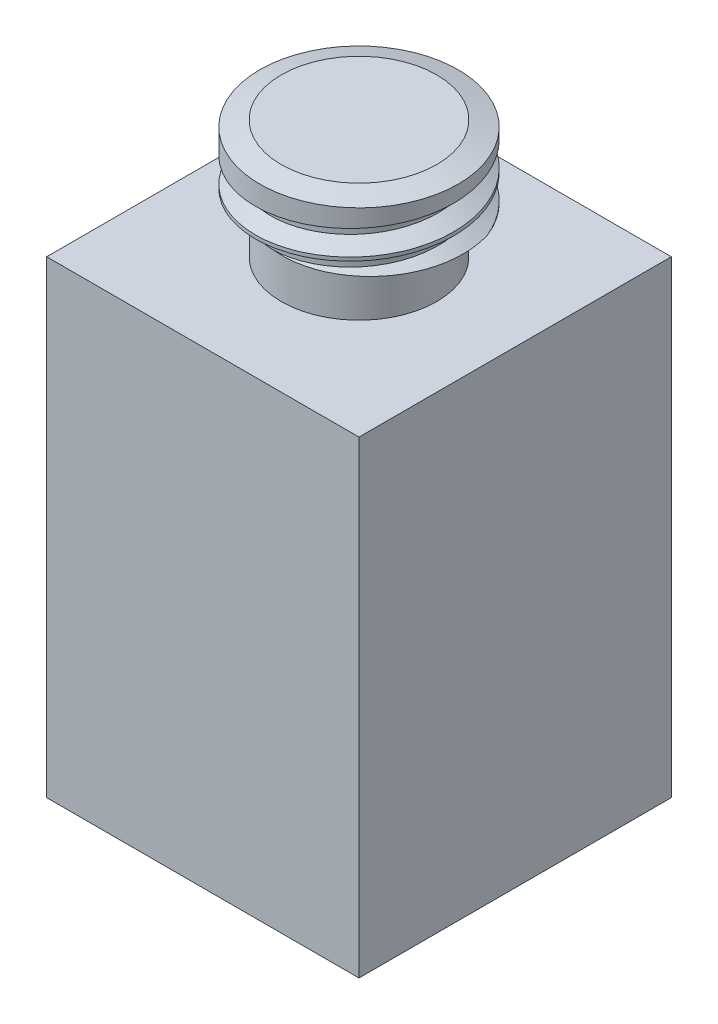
SolidWorks part; units mm, degrees
ref_plane "Front Plane" through (0, 0, 0) normal (0, 0, 1) x (1, 0, 0)
ref_plane "Top Plane" through (0, 0, 0) normal (0, 1, 0) x (1, 0, 0)
ref_plane "Right Plane" through (0, 0, 0) normal (1, 0, 0) x (0, 0, -1)
sketch "Sketch1" plane through (0, 0, 0) normal (0, 1, 0) x (1, 0, 0)
  line L1 (-5, 5) -> (5, 5)
  line L2 (-5, 5) -> (-5, -5)
  line L3 (-5, -5) -> (5, -5)
  line L4 (5, 5) -> (5, -5)
  line L5 (-5, 5) -> (5, -5) construction
  line L6 (-5, -5) -> (5, 5) construction
  point P0 (0, 0)
  dimension "D1" = 10
  dimension "D2" = 10
extrude "Boss-Extrude1" add sketch "Sketch1" along normal blind 15
hole_wizard "#8-32 Tapped Hole1" positions "Sketch2" profile "Sketch4" tap size "#8-32" standard "ANSI Inch"
sketch "Sketch2" plane through (0, 0, 0) normal (0, -1, 0) x (-1, 0, 0)
  point P0 (0, 0)
sketch "Sketch4" plane through (0, 0, 0) normal (1, 0, 0) x (0, 0, -1)
  line L0 (0, 0) -> (0, 6.5378)
  line L1 (0, 6.5378) -> (1.7272, 5.5)
  line L2 (1.7272, 5.5) -> (1.7272, 0)
  line L5 (1.7272, 0) -> (0, 0)
  line L10 (0, 6.5378) -> (-1.7272, 5.5) construction
  line L11 (0, -6.35) -> (0, 107.95) construction
  dimension "Tap Drill Dia." = 3.4544
  dimension "Tap Drill Depth" = 5.5
  dimension "Drill Angle" = 118
sketch "Sketch6" plane through (0, 15, 0) normal (0, 1, 0) x (1, 0, 0)
  circle A0 centre (0, 0) radius 2.4892
  dimension "D1" = 4.9784
extrude "Boss-Extrude2" add sketch "Sketch6" along normal blind 1.5
sketch "Sketch18" plane through (0, 16.5, 0) normal (0, 1, 0) x (1, 0, 0)
  circle A0 centre (0, 0) radius 3.175
  dimension "D1" = 6.35
extrude "Boss-Extrude3" add sketch "Sketch18" along normal blind 2.1
sketch "Sketch23" plane through (0, 0, 0) normal (0, 0, 1) x (1, 0, 0)
  line L0 (3.175, 18.6) -> (0, 18.6)
  line L2 (0, 18.8) -> (2.4892, 18.8)
  line L3 (2.4892, 18.8) -> (3.175, 18.6)
  line L4 (0, 18.6) -> (0, 18.8)
  dimension "D1" = 0.2
revolve "Revolve3" add sketch "Sketch23" angle 360 about L4
thread "Thread4" pitch 0.9071 start angle 0, offset 0, length 2.3, pitch 0.9071, diameter 6.35
ref_plane "Plane5" through (-3.175, 18.6, 0) normal (0, 0, 1) x (-1, 0, 0)
sketch "Thread Profile5" plane through (-3.175, 18.6, 0) normal (0, 0, 1) x (-1, 0, 0)
  line L0 (0, 0) -> (0, 0.9071) construction
  line L11 (0, 0) -> (0, 0.7937)
  line L12 (0, 0.7937) -> (-0.491, 0.5103)
  line L13 (-0.491, 0.5103) -> (-0.491, 0.2835)
  line L15 (-0.491, 0.2835) -> (0, 0)
  line L17 (-0.491, 0.3969) -> (0, 0.3969) construction
  point P2 (0, 0)
  dimension "Pitch" = 0.9071
  dimension "Profile_Angle" = 60
  dimension "Profile_Land" = 0.2268
  dimension "Profile_Height" = 0.491
